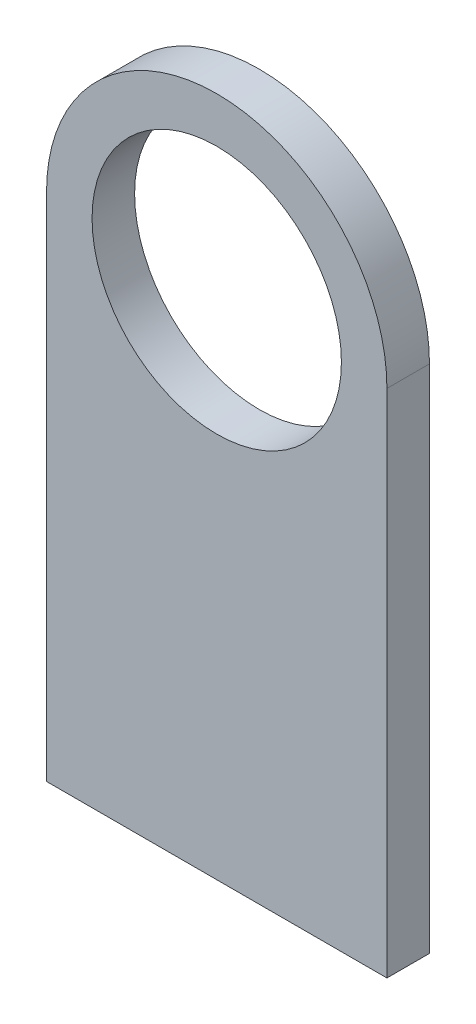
SolidWorks part; units mm, degrees
ref_plane "Front Plane" through (0, 0, 0) normal (0, 0, 1) x (1, 0, 0)
ref_plane "Top Plane" through (0, 0, 0) normal (0, 1, 0) x (1, 0, 0)
ref_plane "Right Plane" through (0, 0, 0) normal (1, 0, 0) x (0, 0, -1)
sketch "Sketch1" plane through (0, 0, 0) normal (0, 0, 1) x (1, 0, 0)
  line L0 (-36.9099, -55.751) -> (-36.9099, 89.8513) construction
  line L1 (-36.9099, -55.751) -> (39.2901, -55.751)
  line L2 (39.2901, -55.751) -> (39.2901, 93.73) construction
  line L3 (39.2901, -55.751) -> (39.2901, 58.549)
  line L4 (-36.9099, 58.549) -> (-36.9099, -55.751)
  circle A0 centre (1.1901, 58.549) radius 27.9082
  arc A1 (-36.9099, 58.549) -> (39.2901, 58.549) centre (1.1901, 58.549) cw
  dimension "D3" = 114.3
  dimension "D4" = 55.8165
  dimension "D1" = 38.1
extrude "Extrude1" add sketch "Sketch1" along normal blind 9.525
